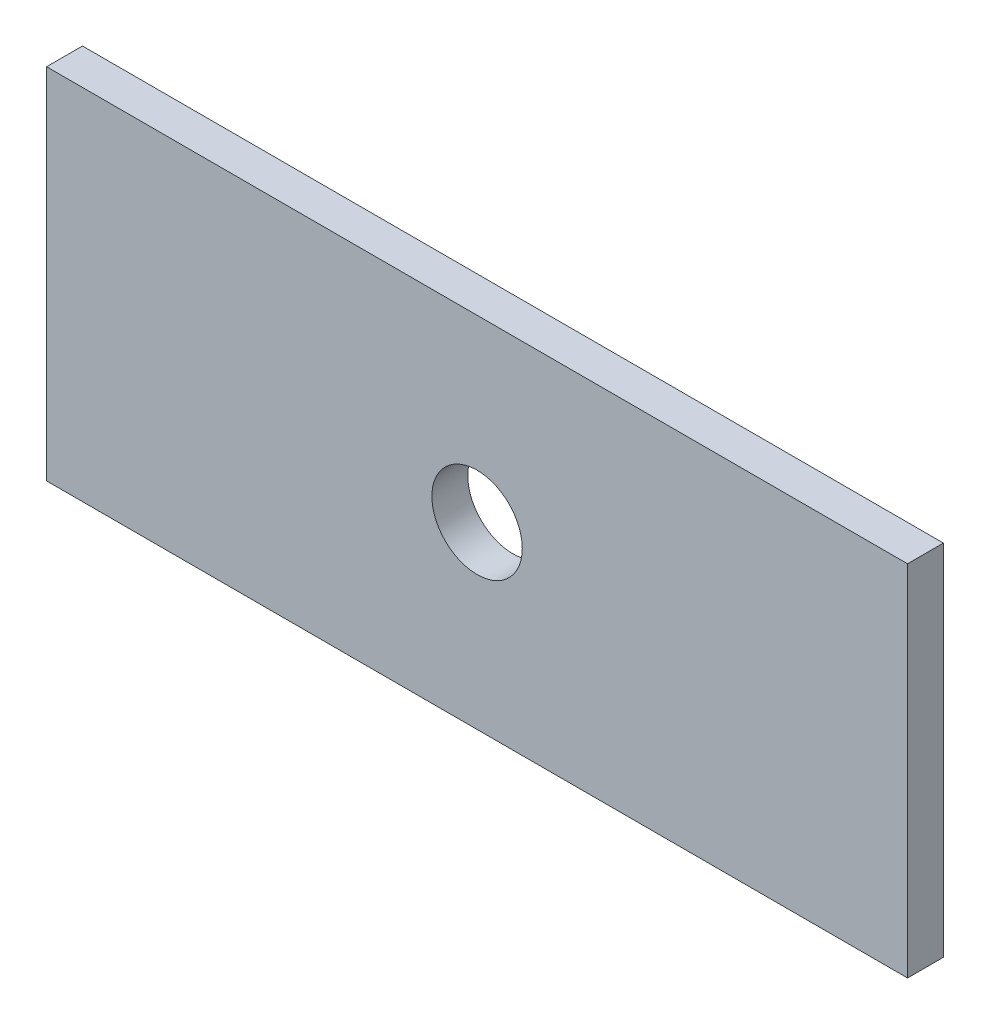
SolidWorks part; units mm, degrees
ref_plane "Front Plane" through (0, 0, 0) normal (0, 0, 1) x (1, 0, 0)
ref_plane "Top Plane" through (0, 0, 0) normal (0, 1, 0) x (1, 0, 0)
ref_plane "Right Plane" through (0, 0, 0) normal (1, 0, 0) x (0, 0, -1)
sketch "Sketch2" plane through (0, 0, 0) normal (0, 0, 1) x (1, 0, 0)
  line L1 (0, 0) -> (76.2, 0)
  line L2 (0, 0) -> (0, 31.75)
  line L3 (0, 31.75) -> (76.2, 31.75)
  line L4 (76.2, 0) -> (76.2, 31.75)
  dimension "D1" = 76.2
  dimension "D2" = 31.75
extrude "Boss-Extrude1" add sketch "Sketch2" along normal blind 3.175
sketch "Sketch3" plane through (0, 0, 3.175) normal (0, 0, 1) x (1, 0, 0)
  line L0 (0, 31.75) -> (76.2, 0)
  circle A0 centre (38.1, 15.875) radius 4.0005
  dimension "D1" = 8.001
extrude "Cut-Extrude1" cut sketch "Sketch3" against normal through all contours A0
